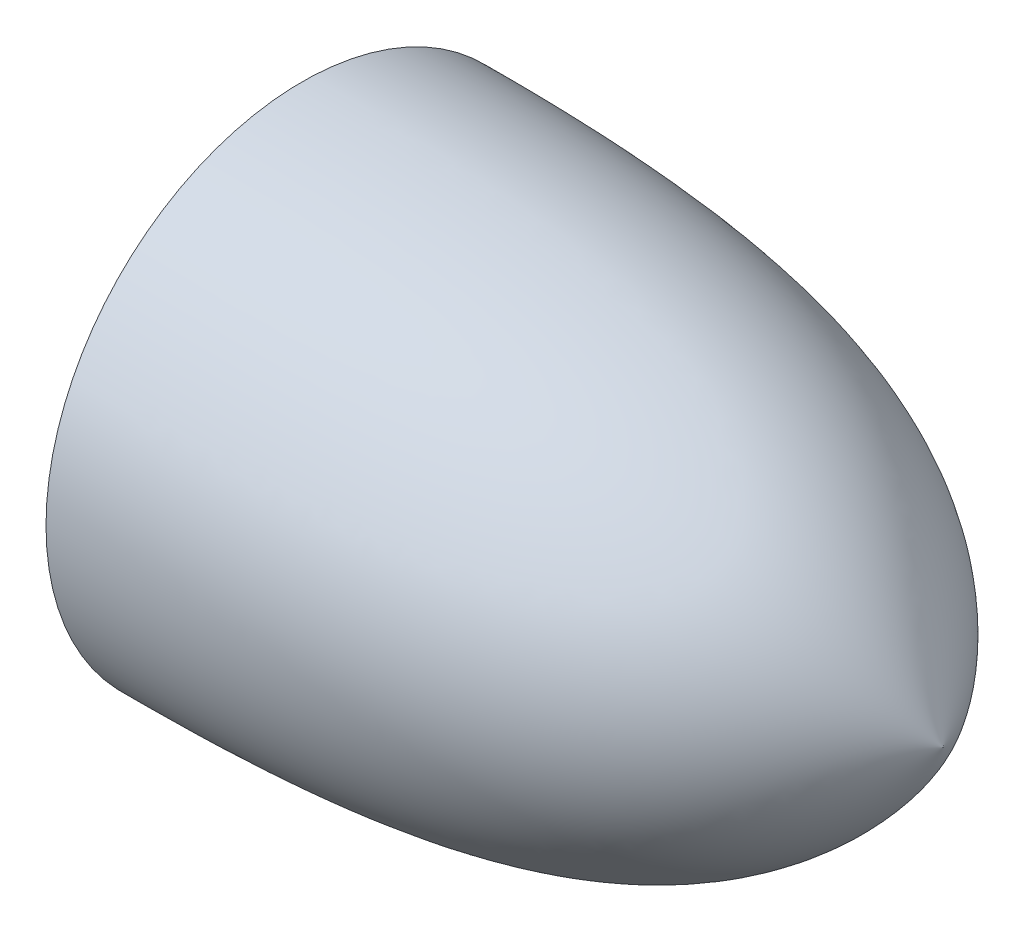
SolidWorks part; units mm, degrees
ref_plane "Plan de face" through (0, 0, 0) normal (0, 0, 1) x (1, 0, 0)
ref_plane "Plan de dessus" through (0, 0, 0) normal (0, 1, 0) x (1, 0, 0)
ref_plane "Plan de droite" through (0, 0, 0) normal (1, 0, 0) x (0, 0, -1)
sketch "Esquisse1" plane through (0, 0, 0) normal (0, 1, 0) x (1, 0, 0)
  line L0 (-6.1095, 0) -> (28.837, 0) construction
  line L1 (0, -5.3491) -> (0, 14.2458) construction
  line L2 (5, 14.2458) -> (5, -6.0096) construction
  line L3 (0, 2) -> (0, 0)
  line L4 (-1.6502, 2) -> (14.8074, 2) construction
  line L5 (0, 0) -> (5, 0)
  spline S0 degree 3 poles (0, 2) (2.6551, 2.0086) (4.187, 1.6686) (5, 0) knots 0 0 0 0 0.789485 0.789485 0.789485 0.789485
  dimension "D1" = 5
  dimension "D2" = 2
revolve "Révolution1" add sketch "Esquisse1" angle 360 about L0
sketch "Esquisse2" plane through (0, 0, 0) normal (-1, 0, 0) x (0, 0, 1)
  circle A0 centre (0, 0) radius 0.5
extrude "Enlèv. mat.-Extru.1" cut sketch "Esquisse2" against normal blind 3
